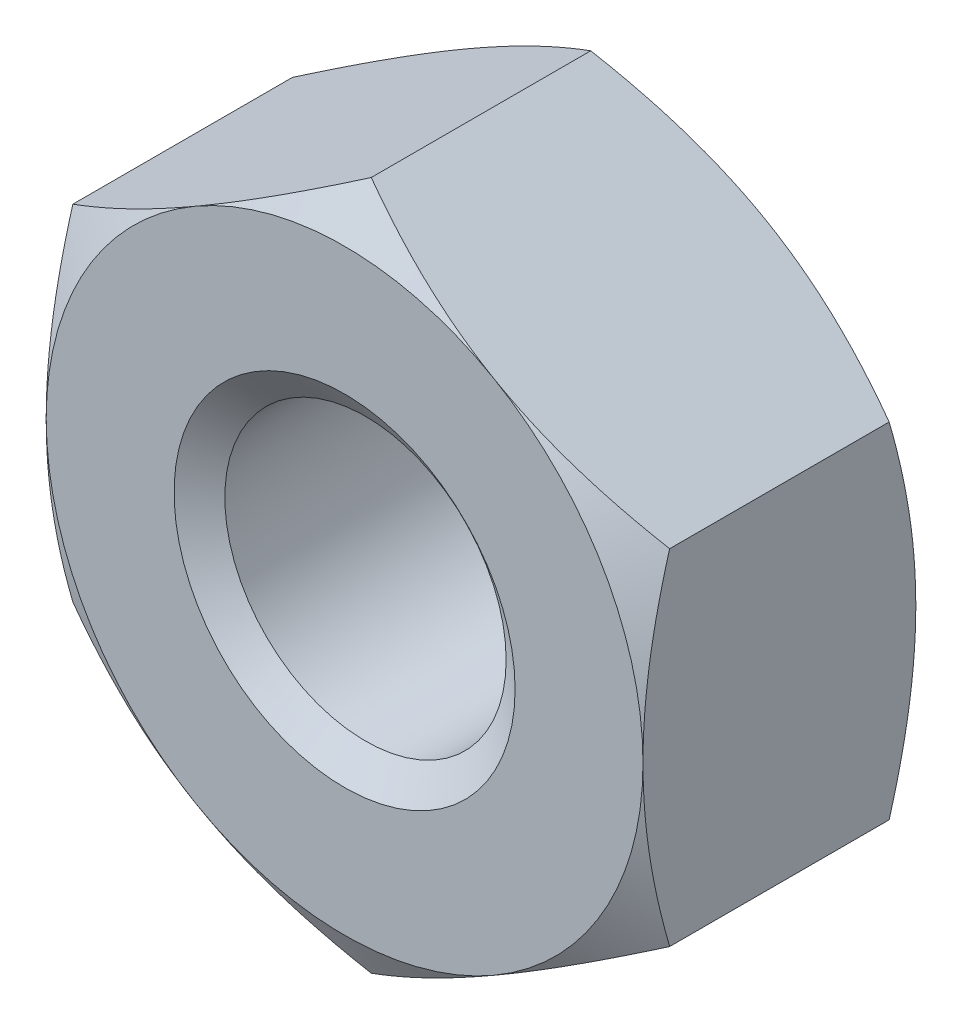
SolidWorks part; units mm, degrees
ref_plane "Plane1" through (0, 0, 0) normal (0, 0, 1) x (1, 0, 0)
ref_plane "Plane2" through (0, 0, 0) normal (0, 1, 0) x (1, 0, 0)
ref_plane "Plane3" through (0, 0, 0) normal (1, 0, 0) x (0, 0, -1)
sketch "BaseNutSke" plane through (0, 0, 0) normal (0, 0, 1) x (1, 0, 0)
  line L6 (3.5, 2.0207) -> (3.5, -2.0207)
  line L7 (-3.5, 2.0207) -> (-3.5, -2.0207)
  line L8 (3.5, 2.0207) -> (0, 4.0415)
  line L9 (0, 4.0415) -> (-3.5, 2.0207)
  line L10 (-3.5, -2.0207) -> (0, -4.0415)
  line L11 (0, -4.0415) -> (3.5, -2.0207)
  circle A0 centre (0, 0) radius 1.65
  dimension "D4" = 3.5
  dimension "Tap_drill" = 3.3
  dimension "D1" = 120
  dimension "D2" = 3.5
  dimension "D3" = 3.5
  dimension "Width_flats" = 7
extrude "BaseNut" add sketch "BaseNutSke" against normal blind 3.2
sketch "Sketch4" plane through (0, 0, 0) normal (1, 0, 0) x (0, 0, -1)
  line L0 (3.2, 3.5) -> (2.8, 3.5)
  line L1 (3.2, 3.5) -> (3.2, 14.0415)
  line L2 (2.8, 14.0415) -> (3.2, 14.0415)
  line L3 (2.8, 14.0415) -> (2.8, 3.5)
  line L4 (0, 0) -> (34.925, 0) construction
  line L6 (3.2, 2.0207) -> (3.2, 4.0415) construction
  line L7 (0, 3.5) -> (-10, 3.5)
  line L8 (0, 2.0207) -> (0, 4.0415) construction
  line L9 (0.3126, 4.0415) -> (0.3126, 14.0415)
  line L10 (0.3126, 14.0415) -> (-10, 14.0415)
  line L11 (-10, 14.0415) -> (-10, 3.5)
  line L12 (0, 3.5) -> (0.3126, 4.0415)
  line L14 (0, 2.0207) -> (0, -2.0207) construction
  line L15 (3.2, 4.0415) -> (0, 4.0415) construction
  dimension "D1" = 3.5
  dimension "D2" = 30
  dimension "Bearing_ht" = 0.4
  dimension "D3" = 10
  dimension "D4" = 10
revolve "Bearing-Face" [suppressed] cut sketch "Sketch4" angle 360 about L4
sketch "Sketch3" plane through (0, 0, 0) normal (1, 0, 0) x (0, 0, -1)
  line L0 (3.2, 3.5) -> (2.8874, 4.0415)
  line L1 (2.8874, 4.0415) -> (2.8874, 14.0415)
  line L2 (2.8874, 14.0415) -> (13.2, 14.0415)
  line L3 (13.2, 14.0415) -> (13.2, 3.5)
  line L4 (13.2, 3.5) -> (3.2, 3.5)
  line L5 (3.2, 2.0207) -> (3.2, 4.0415) construction
  line L6 (3.2, 4.0415) -> (0, 4.0415) construction
  line L7 (0, 0) -> (38.6776, 0) construction
  line L8 (3.2, 0) -> (0, 0) construction
  line L9 (1.6, 4.0415) -> (1.6, 44.222) construction
  line L10 (0.3126, 14.0415) -> (-10, 14.0415)
  line L11 (-10, 14.0415) -> (-10, 3.5)
  line L12 (-10, 3.5) -> (0, 3.5)
  line L13 (0, 3.5) -> (0.3126, 4.0415)
  line L14 (0.3126, 4.0415) -> (0.3126, 14.0415)
  line L16 (3.2, 4.0415) -> (0, 4.0415) construction
  dimension "D1" = 3.5
  dimension "D2" = 30
  dimension "D3" = 10
  dimension "D4" = 10
revolve "Double-Chamfer" cut sketch "Sketch3" angle 360 about L7
sketch "Sketch5"
  line L0 (3.1746, 2) -> (2.905, 1.615)
  line L1 (3.2254, 2) -> (3.1746, 2)
  line L2 (3.2254, 2) -> (3.2254, 1.615)
  line L3 (3.2254, 1.615) -> (2.905, 1.615)
  line L6 (-0.0508, 2) -> (0, 2)
  line L7 (0, 2) -> (0.2696, 1.615)
  line L9 (0.2696, 1.615) -> (-0.0508, 1.615)
  line L10 (-0.0508, 1.615) -> (-0.0508, 2)
  line L11 (25.0375, 0) -> (38.388, 0) construction
  line L12 (3.2, 0) -> (0, 0) construction
pattern_linear "ThdSchPat" [suppressed]
revolve "ThreadSchematic" cut sketch "ThdSchSke" angle 360 about L6
sketch "ThdSchSke" plane through (0, 0, 0) normal (0, 1, 0) x (1, 0, 0)
  line L0 (-2, 0.0254) -> (-1.65, 0.2705)
  line L1 (-1.65, 0.2705) -> (-0.825, 0.2705)
  line L2 (-0.825, 0.2705) -> (-0.825, -0.2197)
  line L3 (-0.825, -0.2197) -> (-1.65, -0.2197)
  line L4 (-1.65, -0.2197) -> (-2, 0.0254)
  line L5 (-3.175, 0.7) -> (3.175, 0.7) construction
  line L6 (0, 0.7) -> (0, -2.9874) construction
  line L7 (0, 2.9295) -> (0, 0.2451) construction
  dimension "D1" = 0.0254
  dimension "VeeAngle" = 70
  dimension "SideAngle" = 55
  dimension "OverCut" = 1.65
  dimension "Tap_Drill" = 3.3
  dimension "Advance" = 0.7
  dimension "Thread_major" = 4
revolve "EndChamfer" cut sketch "Sketch5" angle 360 about L11
equation "\"D2@BaseNutSke\" = \"Width_flats@BaseNutSke\" / 2"
equation "\"D3@BaseNutSke\" = \"Width_flats@BaseNutSke\" / 2"
equation "\"D1@Sketch3\" = \"Width_flats@BaseNutSke\" /2"
equation "\"D1@Sketch4\" = \"D2@BaseNutSke\""
equation "\"D4@BaseNutSke\" = \"D3@BaseNutSke\""
equation "\"Thread_major@ThdSchSke\" = \"Thread_major@ThreadCosmetic\""
equation "\"Tap_drill@ThdSchSke\" = \"Tap_drill@BaseNutSke\""
equation "\"Overcut@ThdSchSke\" = \"Tap_drill@ThdSchSke\" * 0.5"
equation "\"Num_threads@ThdSchPat\" = int(  ( \"Thickness@BaseNut\" - 0.0508 ) / \"Advance@ThdSchSke\" + 0.999 )  + 1"
equation "\"Advance@ThdSchPat\" = ( \"Thickness@BaseNut\" - 0.0508 ) /  (\"Num_threads@ThdSchPat\" - 1) 'relax it"
equation "' \"Num_threads@ThdSchPat\" = \"Num_threads@ThdSchPat\" - sgn( \"Num_threads@ThdSchPat\" - 1) '---chamfered tips only---"
equation "\"ThreadMajor@Sketch5\" = \"Thread_major@ThreadCosmetic\" * 0.5"
equation "\"ChamferDepth@Sketch5\" = (\"Thread_major@ThreadCosmetic\" - \"Tap_drill@BaseNutSke\") * 0.55"
equation "\"Offset1@Sketch5\" = \"Thickness@BaseNut\" + 0.0254"
equation "\"Offset2@Sketch5\" = \"Offset1@Sketch5\" + 0.0508"
